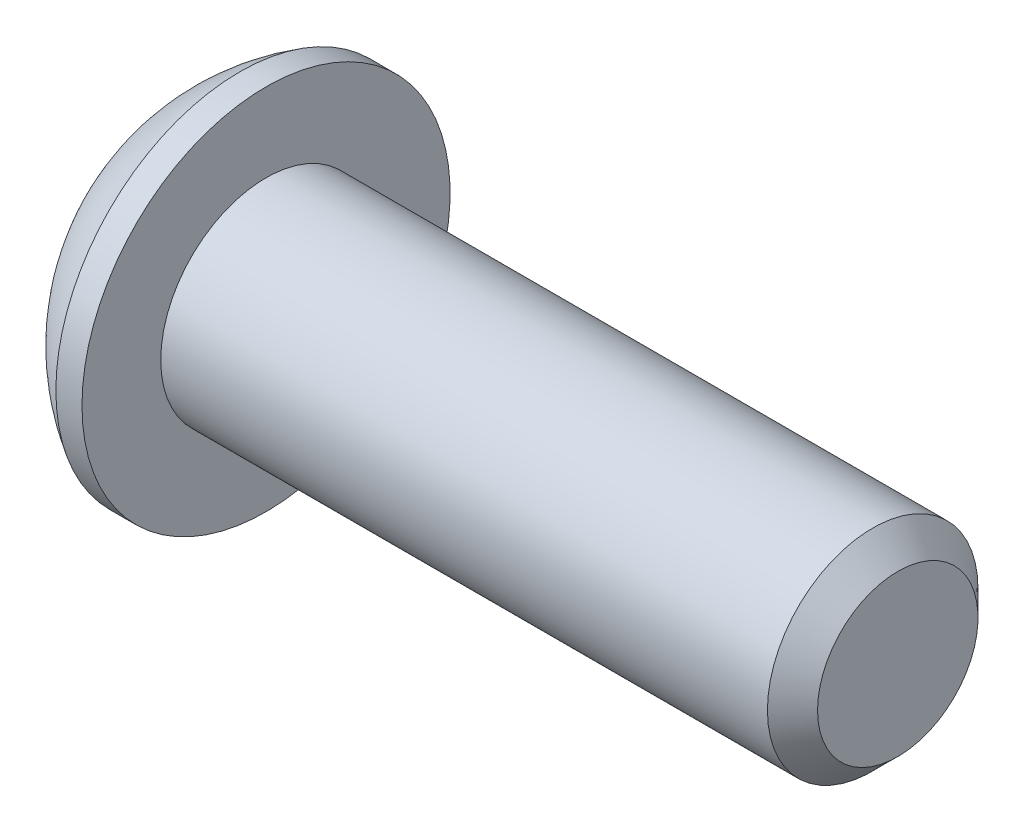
SolidWorks part; units mm, degrees
ref_plane "Plane1" through (0, 0, 0) normal (0, 0, 1) x (1, 0, 0)
ref_plane "Plane2" through (0, 0, 0) normal (0, 1, 0) x (1, 0, 0)
ref_plane "Plane3" through (0, 0, 0) normal (1, 0, 0) x (0, 0, -1)
sketch "BodySke" plane through (0, 0, 0) normal (0, 0, 1) x (1, 0, 0)
  line L0 (22.4028, 0) -> (22.4028, 2.4193)
  line L1 (21.6472, 3.175) -> (3.3528, 3.175)
  line L2 (3.3528, 3.175) -> (3.3528, 5.5499)
  line L3 (3.3528, 5.5499) -> (2.5654, 5.5499)
  line L4 (0, 0) -> (101.6, 0) construction
  line L5 (3.3528, -5.5499) -> (2.5654, -5.5499) construction
  line L6 (55.6768, -3.175) -> (3.3528, -3.175) construction
  line L7 (22.4028, 0) -> (0, 0)
  line L8 (0, 2.775) -> (0, -2.775) construction
  line L9 (0, 0) -> (0, 2.775)
  line L10 (22.4028, 2.4193) -> (21.6472, 3.175)
  line L11 (22.4028, -2.4193) -> (21.6472, -3.175) construction
  line L12 (4.6228, 9.525) -> (4.6228, -3.175) construction
  line L13 (3.3528, 9.525) -> (3.3528, -3.175) construction
  arc A1 (0, 2.775) -> (2.5654, 5.5499) centre (5.7851, 0) cw
  dimension "D1" = 5.5499
  dimension "Diameter" = 6.35
  dimension "Length" = 19.05
  dimension "Head_dia" = 11.0998
  dimension "Head_ht" = 3.3528
  dimension "Head_side_ht" = 0.7874
  dimension "Minor_dia" = 4.8387
  dimension "Body_ch_ang" = 45
  dimension "Advance" = 1.27
  dimension "Thread_nom" = 19.05
revolve "BaseBody" add sketch "BodySke" angle 360 about L4
sketch "Sketch2" plane through (0, 0, 0) normal (0, 0, 1) x (1, 0, 0)
  line L0 (0, 1.9812) -> (2.2098, 1.9812)
  line L1 (2.2098, 1.9812) -> (3.3536, 0)
  line L3 (3.3536, 0) -> (0, 0)
  line L4 (0, 0) -> (0, 1.9812)
  line L5 (0, -1.9812) -> (2.2098, -1.9812) construction
  line L6 (0, 0) -> (47.625, 0) construction
  dimension "D2" = 60
  dimension "PreBroach_depth" = 2.2098
  dimension "PreBroach_dia" = 3.9624
revolve "PreBroach" cut sketch "Sketch2" angle 360 about L6
sketch "Sketch3" plane through (0, 0, 0) normal (1, 0, 0) x (0, 0, -1)
  line L0 (-1.9812, -1.1438) -> (-1.9812, 1.1438)
  line L1 (-1.9812, 1.1438) -> (0, 2.2877)
  line L2 (0, 2.2877) -> (1.9812, 1.1438)
  line L3 (1.9812, 1.1438) -> (1.9812, -1.1438)
  line L4 (1.9812, -1.1438) -> (0, -2.2877)
  line L5 (0, -2.2877) -> (-1.9812, -1.1438)
  dimension "D1" = 1.9812
  dimension "D2" = 1.9812
  dimension "D3" = 3.9624
  dimension "Hex_size" = 3.9624
extrude "Hex" cut sketch "Sketch3" along normal blind 2.2098
sketch "Sketch4" plane through (0, 9.525, 0) normal (1, 0, 0) x (0, 0, -1)
  line L0 (0, -9.525) -> (2.3876, -9.525)
  line L1 (0, -9.525) -> (6.1484, -5.9752) construction
  line L2 (0, -9.525) -> (1.1938, -7.4573)
  line L3 (1.9883, -8.949) -> (2.2704, -8.7861)
  line L4 (1.493, -8.0911) -> (1.7751, -7.9282)
  arc A0 (1.9883, -8.949) -> (1.493, -8.0911) centre (0, -9.525) ccw
  arc A1 (2.3876, -9.525) -> (2.2704, -8.7861) centre (0, -9.525) ccw
  arc A2 (1.1938, -7.4573) -> (1.7751, -7.9282) centre (0, -9.525) cw
  dimension "D1" = 30
  dimension "Spline_n_dim" = 4.1402
  dimension "Spline_m_dim" = 4.7752
  dimension "D2" = 60
  dimension "D3" = 0.4953
  dimension "Spline_p_dim" = 0.9906
extrude "Spline" [suppressed] cut sketch "Sketch4" along normal blind 2.2098
pattern_circular "CirPattern1" [suppressed] count 6 every 60 about axis through (0, 0, 0) along (1, 0, 0)
sketch "ThdSchSke" plane through (0, 0, 0) normal (0, 0, 1) x (1, 0, 0)
  line L0 (4.6228, -2.4193) -> (4.0937, -3.175)
  line L1 (4.6228, -2.4193) -> (5.1519, -3.175)
  line L2 (5.1519, -3.175) -> (5.1519, -3.9688)
  line L3 (-3.175, 0) -> (5.1513, 0) construction
  line L5 (5.1519, -3.9688) -> (4.0937, -3.9688)
  line L6 (4.0937, -3.9688) -> (4.0937, -3.175)
  dimension "Thread_minor" = 4.8387
  dimension "Diameter" = 6.35
  dimension "Start" = 4.6228
  dimension "SideAngle" = 55
  dimension "VeeAngle" = 70
  dimension "Overcut" = 7.9375
revolve "ThreadSchematic" [suppressed] cut sketch "ThdSchSke" angle 360 about L3
pattern_linear "ThdSchPat" [suppressed]
equation "\"D1@BodySke\" = \"Head_dia@BodySke\" * .5"
equation "\"Thread_minor@ThreadCosmetic\" = \"Minor_dia@BodySke\""
equation "\"D1@Sketch3\" = \"Hex_size@Sketch3\" / 2"
equation "\"D2@Sketch3\" = \"D1@Sketch3\""
equation "\"D3@Sketch3\" = \"Hex_size@Sketch3\""
equation "\"D3@Sketch4\" = \"Spline_p_dim@Sketch4\" / 2"
equation "\"D1@Sketch4\" = \"D2@Sketch4\" / 2"
equation "\"Thread_length@ThreadCosmetic\" = ((sgn( (\"Length@BodySke\" - \"Advance@BodySke\" ) - \"Thread_nom@BodySke\" )-1)*( (\"Length@BodySke\" - \"Advance@BodySke\" ) - \"Thread_nom@BodySke\" ))/-2+ \"Thread_nom@BodySke\""
equation "\"Thread_minor@ThdSchSke\" = \"Minor_dia@BodySke\""
equation "\"Diameter@ThdSchSke\" = \"Diameter@BodySke\""
equation "\"Overcut@ThdSchSke\" = \"Diameter@BodySke\" * 1.25"
equation "\"Start@ThdSchSke\" = \"Head_ht@BodySke\" + \"Length@BodySke\" - \"Thread_length@ThreadCosmetic\"  '---Non-countersunk---"
equation "\"Num_threads@ThdSchPat\" = int( \"Thread_length@ThreadCosmetic\" / \"Advance@BodySke\" + 0.999 )  + 1"
equation "\"Advance@ThdSchPat\" = \"Thread_length@ThreadCosmetic\" /  (\"Num_threads@ThdSchPat\" - 1) 'relax it"
equation "\"Num_threads@ThdSchPat\" = \"Num_threads@ThdSchPat\" - sgn( \"Num_threads@ThdSchPat\" - 1) '---chamfered tips only---"
